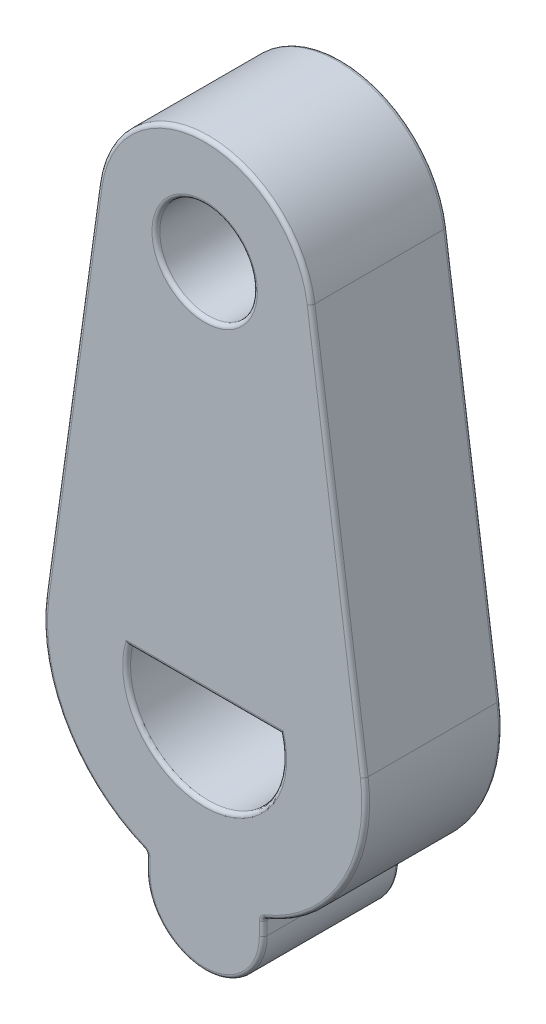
SolidWorks part; units mm, degrees
ref_plane "Face" through (0, 0, 0) normal (0, 0, 1) x (1, 0, 0)
ref_plane "Dessus" through (0, 0, 0) normal (0, 1, 0) x (1, 0, 0)
ref_plane "Droite" through (0, 0, 0) normal (1, 0, 0) x (0, 0, -1)
sketch "Esquisse1" plane through (0, 0, 0) normal (0, 0, 1) x (1, 0, 0)
  line L0 (0, 20) -> (0, -27.4686) construction
  line L1 (5.4478, 20.7563) -> (8.1716, 1.1344)
  line L2 (-5.4478, 20.7563) -> (-8.1716, 1.1344)
  line L3 (-3.873, 1) -> (3.873, 1)
  line L4 (3, -8.5) -> (3, -7.8206)
  line L5 (-3, -8.5) -> (-3.0006, -7.8202)
  arc A0 (-8.1716, 1.1344) -> (-3.1249, -7.6353) centre (0, 0) ccw
  arc A1 (5.4478, 20.7563) -> (-5.4478, 20.7563) centre (0, 20) ccw
  circle A2 centre (0, 20) radius 2.5
  arc A3 (-3.873, 1) -> (3.873, 1) centre (0, 0) ccw
  arc A4 (-3, -8.5) -> (3, -8.5) centre (0, -8.5) ccw
  arc A5 (3.1243, -7.6355) -> (8.1716, 1.1344) centre (0, 0) ccw
  arc A6 (-3.1249, -7.6353) -> (-3.0006, -7.8202) centre (-3.2006, -7.8204) cw
  arc A7 (3.1243, -7.6355) -> (3, -7.8206) centre (3.2, -7.8206) ccw
  dimension "D2" = 11
  dimension "D3" = 16.5
  dimension "D4" = 5
  dimension "D5" = 8
  dimension "D7" = 6
  dimension "D9" = 0.2
  dimension "D1" = 20
  dimension "D6" = 1
  dimension "D8" = 8.5
extrude "Extrusion1" add sketch "Esquisse1" along normal blind 7
sketch "Esquisse2" plane through (0, 0, 0) normal (0, 0, -1) x (-1, 0, 0)
  circle A0 centre (0, 20) radius 4
  dimension "D1" = 8
extrude "Extrusion2" add sketch "Esquisse2" along normal blind 1
fillet "Congé1" radius 0.2
